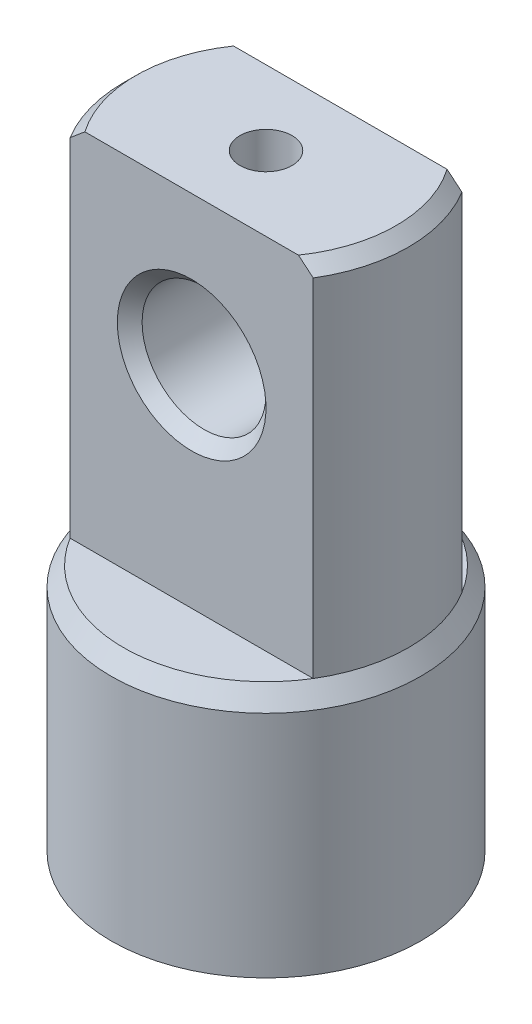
SolidWorks part; units mm, degrees
ref_plane "Front Plane" through (0, 0, 0) normal (0, 0, 1) x (1, 0, 0)
ref_plane "Top Plane" through (0, 0, 0) normal (0, 1, 0) x (1, 0, 0)
ref_plane "Right Plane" through (0, 0, 0) normal (1, 0, 0) x (0, 0, -1)
sketch "Sketch1" plane through (0, 0, 0) normal (0, 0, 1) x (1, 0, 0)
  line L0 (0, 0) -> (12.5, 0)
  line L1 (12.5, 0) -> (12.5, 18.5)
  line L4 (11.5, 20) -> (11.5, 49)
  line L5 (11.5, 49) -> (0, 49)
  line L6 (0, 0) -> (0, 49) construction
  line L7 (0, 0) -> (0, 49)
  line L8 (11.5, 20) -> (12.5, 18.5)
  dimension "D1" = 25
  dimension "D2" = 30.5
  dimension "D3" = 23
  dimension "D4" = 18.5
  dimension "D5" = 29
revolve "Revolve1" add sketch "Sketch1" angle 360 about L6
sketch "Sketch2" plane through (0, 49, 0) normal (0, 1, 0) x (1, 0, 0)
  line L1 (5.7735, 0) -> (2.8868, 5)
  line L2 (2.8868, 5) -> (-2.8868, 5)
  line L3 (-2.8868, 5) -> (-5.7735, 0)
  line L4 (-5.7735, 0) -> (-2.8868, -5)
  line L5 (-2.8868, -5) -> (2.8868, -5)
  line L6 (2.8868, -5) -> (5.7735, 0)
  circle A0 centre (0, 0) radius 5 construction
  dimension "D1" = 10
extrude "Cut-Extrude2" [suppressed] cut sketch "Sketch2" against normal blind 8
sketch "Sketch3" plane through (0, 49, 0) normal (0, 1, 0) x (-1, 0, 0)
  line L0 (0, -6) -> (0, 6) construction
  line L1 (10.9659, -6) -> (-10.9659, -6)
  line L3 (10.9659, 6) -> (-10.9659, 6)
  circle A0 centre (0, 0) radius 12.5 construction
  arc A1 (10.9659, 6) -> (-10.9659, 6) centre (0, 0) ccw
  arc A2 (-10.9659, -6) -> (10.9659, -6) centre (0, 0) ccw
  dimension "D2" = 12
extrude "Cut-Extrude3" cut sketch "Sketch3" against normal blind 29
chamfer "Chamfer1" distance 1 angle 45 2 edges at (11.5, 49, 0) (-11.5, 49, 0)
hole_wizard "Ø10.0 (10) Diameter Hole1" positions "Sketch5" profile "Sketch4" hole size "Ø10.0" standard "ISO"
sketch "Sketch5" plane through (0, 0, 6) normal (0, 0, 1) x (1, 0, 0)
  line L0 (8.6168, 49) -> (-8.6168, 49) construction
  point P0 (0, 37)
  dimension "D1" = 12
sketch "Sketch4" plane through (0, 37, 6) normal (1, 0, 0) x (0, -1, 0)
  line L0 (0, 0) -> (0, 12)
  line L1 (0, 12) -> (5, 12)
  line L2 (5, 12) -> (5, 0)
  line L5 (5, 0) -> (0, 0)
  line L11 (0, -6.35) -> (0, 107.95) construction
  dimension "Thru Hole Dia." = 10
  dimension "Thru Hole Depth" = 12
chamfer "Chamfer2" distance 1 angle 45 2 edges at (5, 37, -6) (5, 37, 6)
hole_wizard "M5 Tapped Hole1" positions "Sketch7" profile "Sketch6" tap size "M5" standard "ISO"
sketch "Sketch7" plane through (0, 49, 0) normal (0, 1, 0) x (-1, 0, 0)
  point P0 (0, 0)
sketch "Sketch6" plane through (0, 49, 0) normal (1, 0, 0) x (0, 0, 1)
  line L0 (0, 0) -> (0, 7)
  line L1 (0, 7) -> (2.1, 7)
  line L2 (2.1, 7) -> (2.1, 0)
  line L5 (2.1, 0) -> (0, 0)
  line L11 (0, -6.35) -> (0, 107.95) construction
  dimension "Thru Tap Drill Dia." = 4.2
  dimension "Thru Tap Drill Depth" = 7
